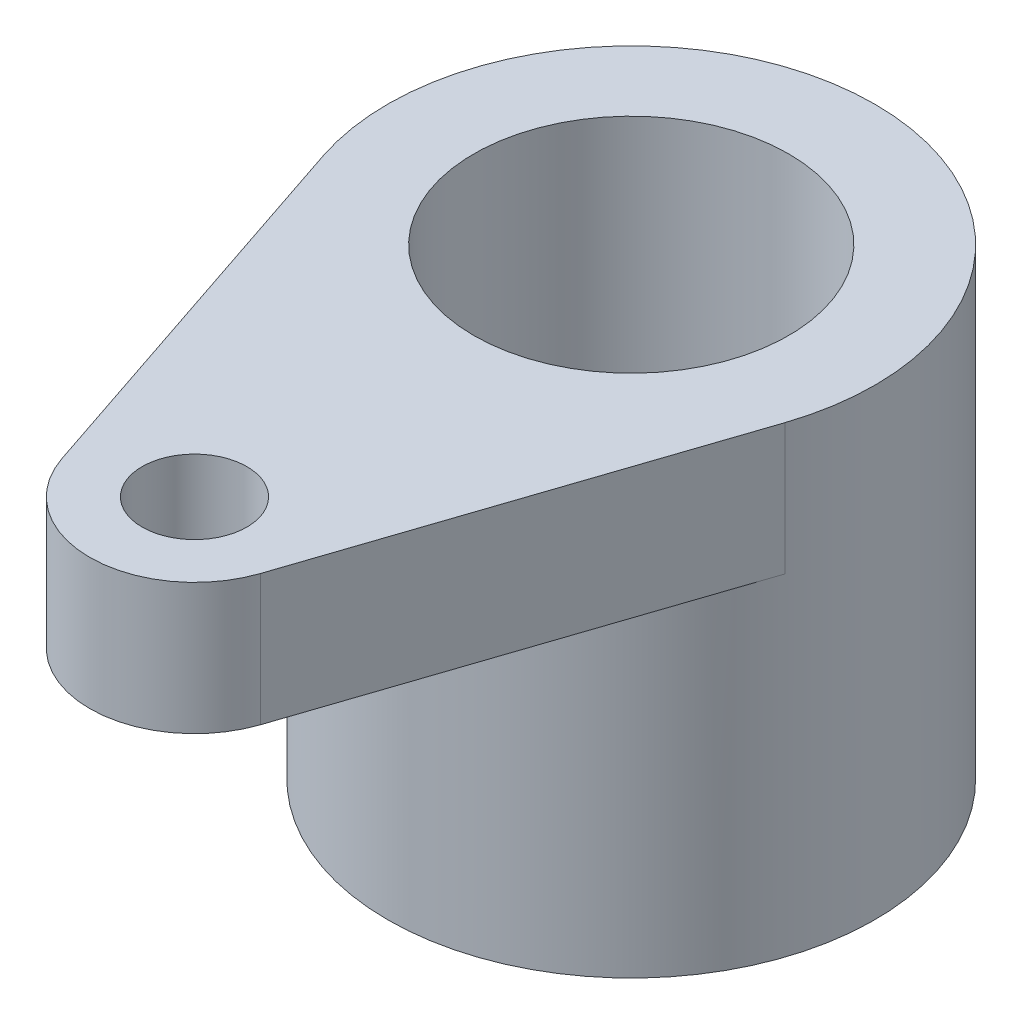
SolidWorks part; units mm, degrees
ref_plane "前视基准面" through (0, 0, 0) normal (0, 0, 1) x (1, 0, 0)
ref_plane "上视基准面" through (0, 0, 0) normal (0, 1, 0) x (1, 0, 0)
ref_plane "右视基准面" through (0, 0, 0) normal (1, 0, 0) x (0, 0, -1)
sketch "草图1" plane through (0, 0, 0) normal (0, 1, 0) x (1, 0, 0)
  line L0 (-44.977, 0) -> (55.9, 0) construction
  line L1 (0, 43.2101) -> (0, -48.6716) construction
  circle A0 centre (0, 0) radius 27.8802
  circle A1 centre (0, 0) radius 18.0231
extrude "凸台-拉伸1" add sketch "草图1" against normal blind 53
sketch "草图2" plane through (0, 0, 0) normal (0, 1, 0) x (1, 0, 0)
  line L0 (0, -73.9139) -> (0, 39.5033) construction
  line L1 (-22.298, -50) -> (30.5566, -50) construction
  line L2 (-26.4367, -8.8549) -> (-11.3787, -53.8113)
  line L3 (26.4367, -8.8549) -> (11.3787, -53.8113)
  circle A0 centre (0, -50) radius 6
  arc A1 (-11.3787, -53.8113) -> (11.3787, -53.8113) centre (0, -50) ccw
  arc A2 (-26.4367, -8.8549) -> (26.4367, -8.8549) centre (0, 0) ccw
  dimension "D1" = 24
  dimension "D2" = 12
  dimension "D3" = 50
extrude "凸台-拉伸2" add sketch "草图2" against normal blind 15
